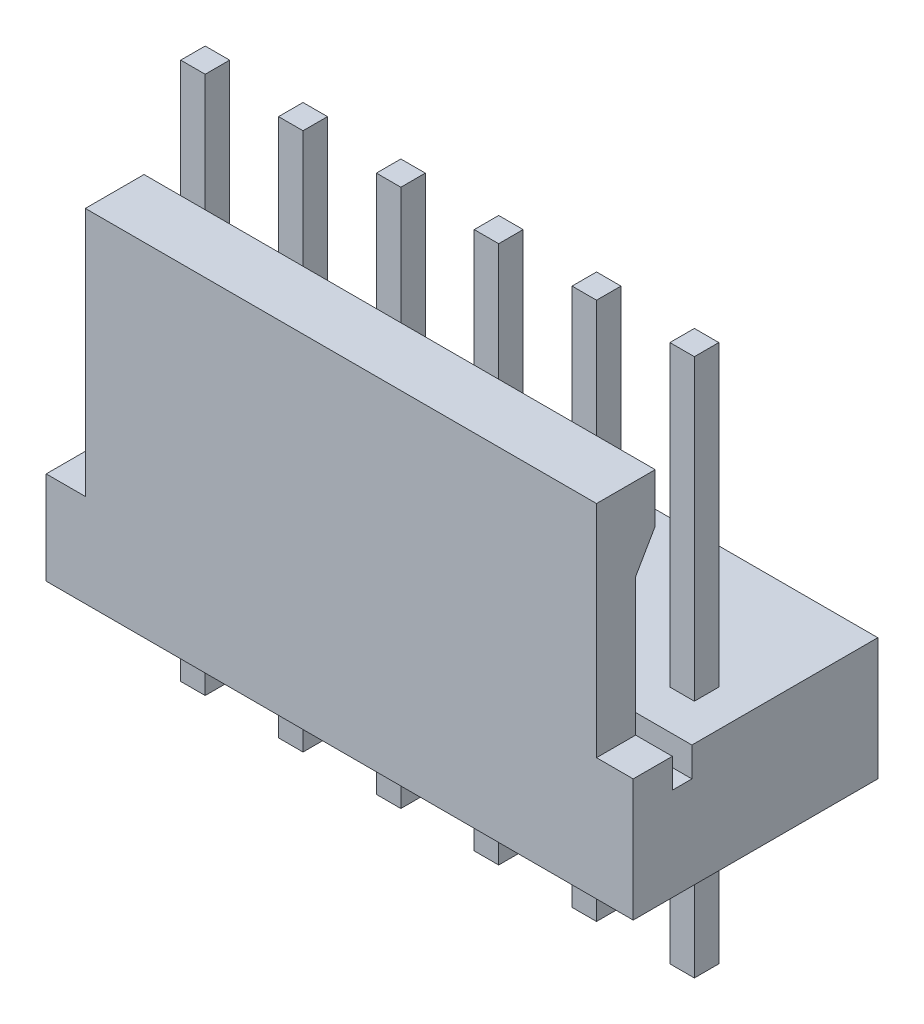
SolidWorks part; units mm, degrees
ref_plane "Front Plane" through (0, 0, 0) normal (0, 0, 1) x (1, 0, 0)
ref_plane "Top Plane" through (0, 0, 0) normal (0, 1, 0) x (1, 0, 0)
ref_plane "Right Plane" through (0, 0, 0) normal (1, 0, 0) x (0, 0, -1)
imported_body "Imported1"
sketch "Sketch1" plane through (0, 0, 0) normal (0, 1, 0) x (1, 0, 0)
  line L0 (32.639, 61.6442) -> (32.639, 48.36) construction
  line L1 (32.639, 59.7216) -> (40.5025, 59.7216)
  line L2 (32.639, 59.7216) -> (32.639, 49.5279)
  line L3 (32.639, 49.5279) -> (40.5025, 49.5279)
  line L4 (40.5025, 59.7216) -> (40.5025, 49.5279)
  line L5 (31.6865, 53.975) -> (31.6865, 53.34) construction
  line L6 (33.5915, 53.975) -> (33.5915, 53.34) construction
extrude "Cut-Extrude1" cut sketch "Sketch1" against normal through all and the other way through all
sketch "Sketch2" plane through (0, 4.699, 0) normal (0, 1, 0) x (1, 0, 0)
  line L0 (31.6865, 53.34) -> (31.6865, 53.975) construction
  line L1 (31.6865, 58.6954) -> (34.7675, 58.6954)
  line L2 (31.6865, 58.6954) -> (31.6865, 48.1798)
  line L3 (31.6865, 48.1798) -> (34.7675, 48.1798)
  line L4 (34.7675, 58.6954) -> (34.7675, 48.1798)
extrude "Cut-Extrude2" cut sketch "Sketch2" along normal through all
